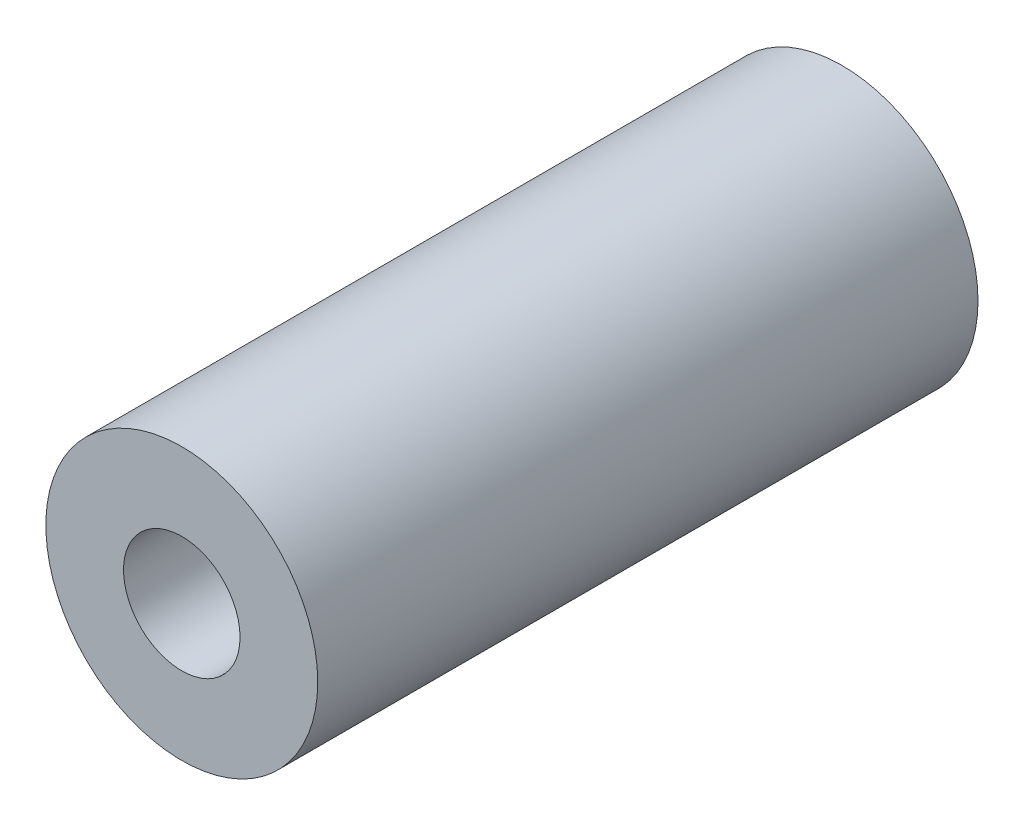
SolidWorks part; units mm, degrees
ref_plane "Front Plane" through (0, 0, 0) normal (0, 0, 1) x (1, 0, 0)
ref_plane "Top Plane" through (0, 0, 0) normal (0, 1, 0) x (1, 0, 0)
ref_plane "Right Plane" through (0, 0, 0) normal (1, 0, 0) x (0, 0, -1)
sketch "Sketch1" plane through (0, 0, 0) normal (0, 0, 1) x (1, 0, 0)
  circle A0 centre (0, 0) radius 11.1125
  circle A1 centre (0, 0) radius 4.7625
  dimension "D1" = 22.225
  dimension "D2" = 9.525
extrude "Boss-Extrude1" add sketch "Sketch1" along normal blind 53.975
